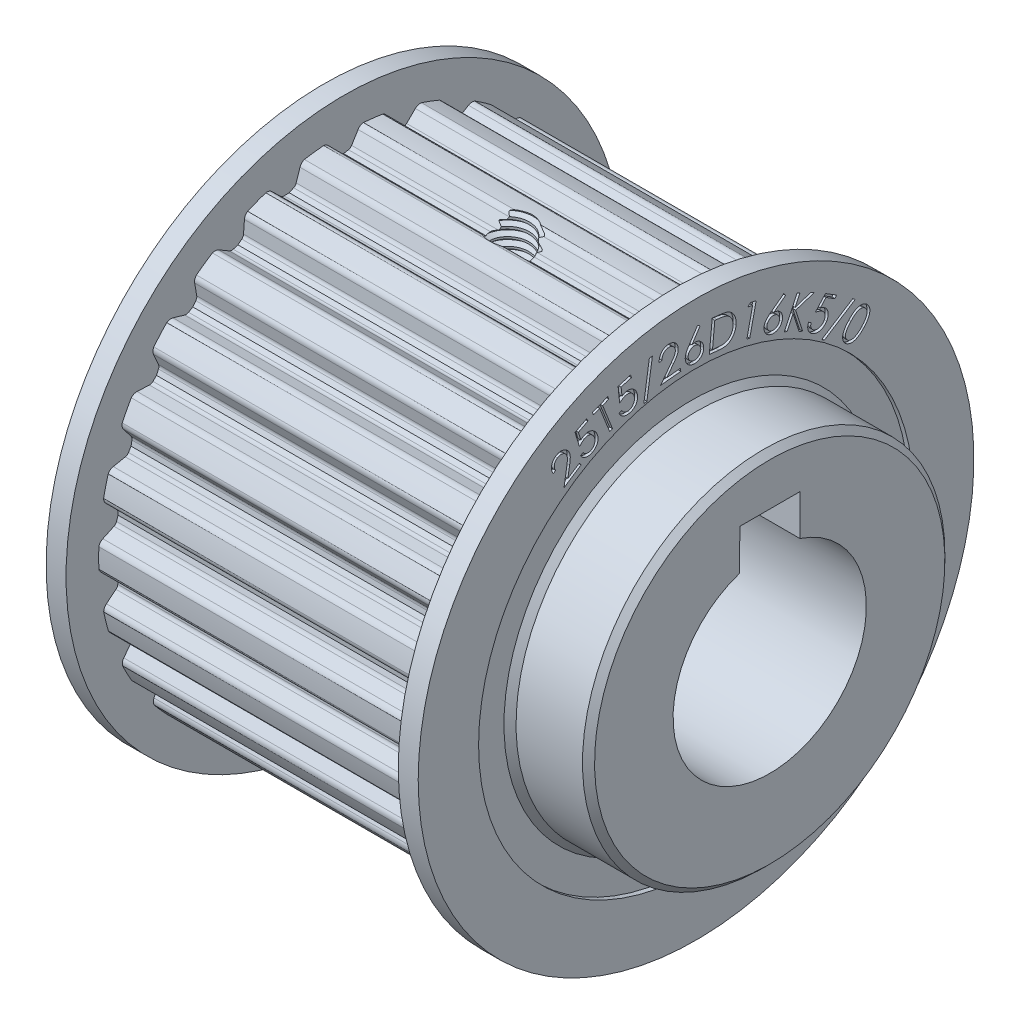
SolidWorks part; units mm, degrees
ref_plane "Front Plane" through (0, 0, 0) normal (0, 0, 1) x (1, 0, 0)
ref_plane "Top Plane" through (0, 0, 0) normal (0, 1, 0) x (1, 0, 0)
ref_plane "Right Plane" through (0, 0, 0) normal (1, 0, 0) x (0, 0, -1)
imported_body "Imported1"
sketch "Sketch1" plane through (30, 0, 0) normal (1, 0, 0) x (0, 0, -1)
  circle A0 centre (0, 0) radius 15
  dimension "D1" = 30
extrude "Boss-Extrude1" add sketch "Sketch1" along normal blind 6.5
chamfer "Chamfer1" distance 0.5 angle 45 2 edges at (30, 0, -15) (36.5, 0, -15)
sketch "Sketch5" plane through (0, 0, 0) normal (-1, 0, 0) x (0, 0, 1)
  circle A0 centre (0, 0) radius 17.5
  dimension "D1" = 35
extrude "Boss-Extrude4" add sketch "Sketch5" along normal blind 1
chamfer "Chamfer2" distance 1 angle 45 1 edges at (-1, 0, 17.5)
move or copy body "Body-Move/Copy1" bodies to move or copy 106 copy no rotation origin (0, 0, 0) rotation axis (1, 0, 0) rotation angle 7
sketch "Sketch8" plane through (36.5, 0, 0) normal (1, 0, 0) x (0, 0, -1)
  line L2 (-2.5, 6.5383) -> (-2.5, 9.9)
  line L3 (-2.5, 9.9) -> (2.5, 9.9)
  line L4 (2.5, 6.5383) -> (2.5, 9.9)
  line L5 (0, 7) -> (2.5, 9.9) construction
  line L6 (-2.5, 9.9) -> (0, 7) construction
  arc A0 (-2.5, 6.5383) -> (2.5, 6.5383) centre (0, 0) ccw
  point P3 (0, 7)
  point P8 (0, 9.9)
  dimension "D1" = 14
  dimension "D2" = 5
  dimension "D3" = 2.9
extrude "Cut-Extrude3" cut sketch "Sketch8" against normal through all
sketch "Sketch9" plane through (0, 9.9, 0) normal (0, -1, 0) x (1, 0, 0)
  line L0 (1, -0.0253) -> (29, -0.0253) construction
  point P0 (15, -0.0253)
hole_wizard "M4 Tapped Hole1" positions "Sketch9" profile "Sketch10" tap size "M4" standard "DIN"
sketch "Sketch10" plane through (15, 9.9, -0.0253) normal (1, 0, 0) x (0, 0, -1)
  line L0 (0, 0) -> (0, 8.9406)
  line L1 (0, 8.9406) -> (1.675, 8.9406)
  line L2 (1.65, 8.9156) -> (1.65, 0)
  line L5 (1.65, 0) -> (0, 0)
  line L7 (1.675, 8.9406) -> (1.65, 8.9156)
  line L8 (-1.675, 8.9406) -> (-1.65, 8.9156) construction
  line L11 (0, -6.35) -> (0, 107.95) construction
  dimension "Thru Tap Drill Dia." = 3.3
  dimension "Thru Tap Drill Depth" = 8.9406
  dimension "Far C'Sink Dia." = 3.35
  dimension "Far C'Sink Angle" = 90
sketch "Sketch11" plane through (29, 0, 0) normal (-1, 0, 0) x (0, 0, 1)
  circle A1 centre (0, 0) radius 21
  circle A2 centre (0, 0) radius 21
  dimension "D1" = 0
extrude "Boss-Extrude5" add sketch "Sketch11" along normal blind 0.25 contours A2
sketch "Sketch12" plane through (1, 0, 0) normal (1, 0, 0) x (0, 0, -1)
  circle A1 centre (0, 0) radius 21
  circle A2 centre (0, 0) radius 21
  dimension "D1" = 0
extrude "Boss-Extrude6" add sketch "Sketch12" along normal blind 0.25
ref_plane "Plane1" through (1.25, 0, 0) normal (1, 0, 0) x (0, 0, -1)
sketch "Sketch13" plane through (1.25, 0, 0) normal (1, 0, 0) x (0, 0, -1)
  circle A0 centre (0, 0) radius 18
  circle A2 centre (0, 0) radius 23
  dimension "D1" = 5
extrude "Boss-Extrude7" add sketch "Sketch13" against normal blind 1.65
ref_plane "Plane2" through (28.75, 0, 0) normal (-1, 0, 0) x (0, 0, 1)
sketch "Sketch14" plane through (28.75, 0, 0) normal (-1, 0, 0) x (0, 0, 1)
  circle A0 centre (0, 0) radius 18
  circle A1 centre (0, 0) radius 23
  dimension "D1" = 5
extrude "Boss-Extrude8" add sketch "Sketch14" against normal blind 1.65
sketch "Sketch15" plane through (1, 0, 0) normal (-1, 0, 0) x (0, 0, 1)
  line L3 (2.5, 9.9) -> (-2.5, 9.9)
  line L4 (-2.5, 9.9) -> (-2.5, 6.5383)
  line L5 (2.5, 6.5383) -> (2.5, 9.9)
  line L6 (2.5, 9.9) -> (-2.5, 9.9)
  line L7 (-2.5, 9.9) -> (-2.5, 6.5383)
  line L8 (2.5, 6.5383) -> (2.5, 9.9)
  arc A1 (-2.5, 6.5383) -> (2.5, 6.5383) centre (0, 0) ccw
  arc A2 (-2.5, 6.5383) -> (2.5, 6.5383) centre (0, 0) ccw
  dimension "D1" = 0
extrude "Cut-Extrude4" cut sketch "Sketch15" against normal through all
sketch "Sketch16" plane through (30.4, 0, 0) normal (1, 0, 0) x (0, 0, -1)
  circle A0 centre (0, 0) radius 18.4853 construction
  text T0 " 25T5/26D16K5/0               " font "Century Gothic" height 2.5
extrude "Cut-Extrude5" cut sketch "Sketch16" against normal blind 0.25
thread "Thread1" pitch 0.7 start angle 0, offset 0, length 12, pitch 0.7, diameter 3.3
ref_plane "Plane3" through (16.65, 9.9, -0.0253) normal (0, 0, 1) x (1, 0, 0)
sketch "Thread Profile1" plane through (16.65, 9.9, -0.0253) normal (0, 0, 1) x (1, 0, 0)
  line L0 (0, 0) -> (0, 0.7) construction
  line L1 (0, 0) -> (0.3789, 0.2187)
  line L2 (0.3789, 0.2187) -> (0.3789, 0.3062)
  line L3 (0.3789, 0.3062) -> (0, 0.525)
  line L4 (0.3789, 0.2625) -> (0, 0.2625) construction
  line L11 (0, 0) -> (0, 0.525)
  point P2 (0, 0)
  dimension "Pitch" = 0.7
  dimension "Profile_Angle" = 60
  dimension "Profile_Land" = 0.0875
  dimension "Profile_Height" = 0.3789
sketch "Sketch17" plane through (36.5, 0, 0) normal (1, 0, 0) x (0, 0, -1)
  line L0 (-2.4494, 10.9593) -> (2.5, 10.9593)
  line L1 (-2.4494, 10.9593) -> (-2.5, 7.5993)
  line L2 (-2.5, 9.9) -> (-2.5, 6.5383) construction
  line L3 (2.5, 10.9593) -> (2.5, 7.5993)
  line L4 (2.5, 6.5383) -> (2.5, 9.9) construction
  arc A0 (-2.5, 7.5993) -> (2.5, 7.5993) centre (0, 0) ccw
  point P6 (0.0253, 10.9593)
  dimension "D1" = 3.36
extrude "Cut-Extrude6" cut sketch "Sketch17" against normal up to surface (37.5 mm away)
